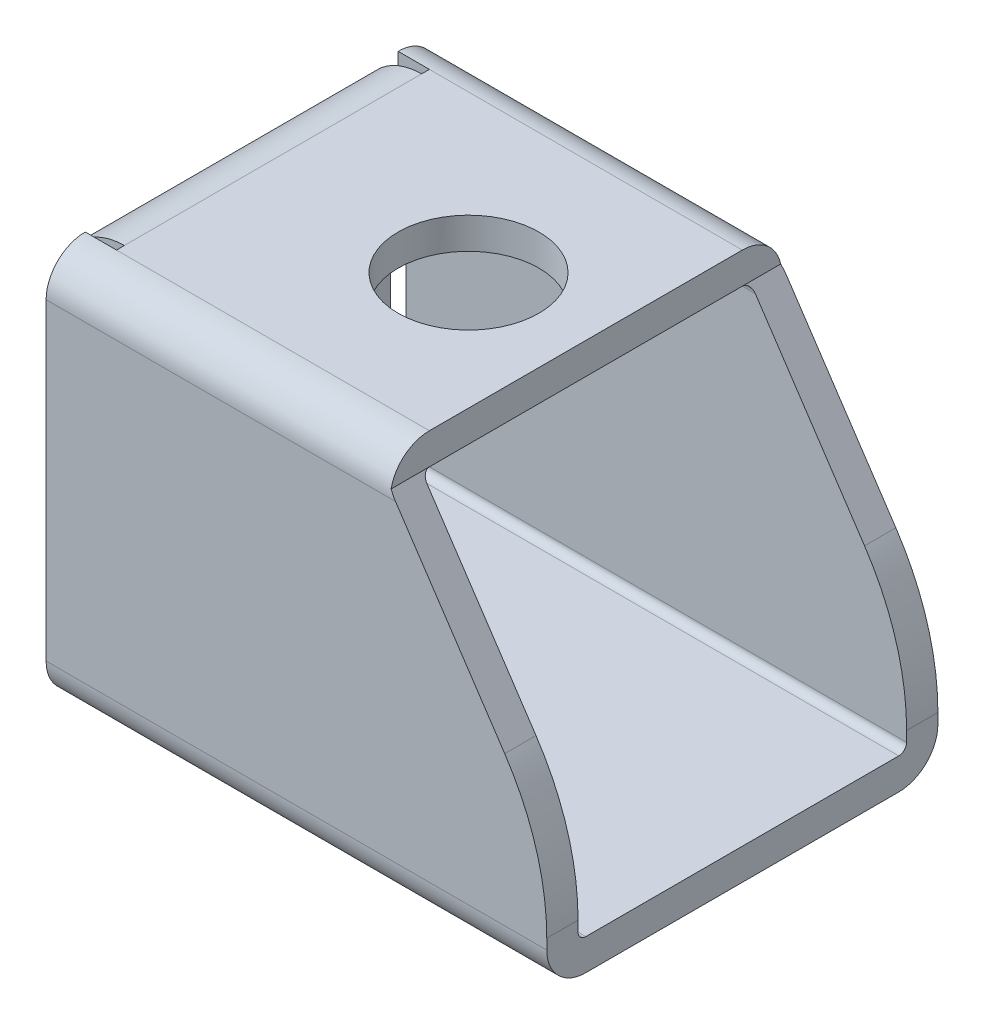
SolidWorks part; units mm, degrees
ref_plane "Plan de face" through (0, 0, 0) normal (0, 0, 1) x (1, 0, 0)
ref_plane "Plan de dessus" through (0, 0, 0) normal (0, 1, 0) x (1, 0, 0)
ref_plane "Plan de droite" through (0, 0, 0) normal (1, 0, 0) x (0, 0, -1)
sketch "Esquisse1" plane through (0, 0, 0) normal (1, 0, 0) x (0, 0, -1)
  line L0 (-10, 10.5) -> (10, 10.5)
  line L1 (-10, 12.5) -> (10, 12.5)
  line L2 (-12.5, 10) -> (-12.5, -10)
  line L3 (-10, -12.5) -> (10, -12.5)
  line L4 (12.5, 10) -> (12.5, -10)
  line L5 (-12.5, 12.5) -> (12.5, -12.5) construction
  line L6 (-12.5, -12.5) -> (12.5, 12.5) construction
  line L7 (10.5, 10) -> (10.5, -10)
  line L8 (-10, -10.5) -> (10, -10.5)
  line L9 (-10.5, 10) -> (-10.5, -10)
  arc A0 (-12.5, -10) -> (-10, -12.5) centre (-10, -10) ccw
  arc A1 (10, -12.5) -> (12.5, -10) centre (10, -10) ccw
  arc A2 (10, 12.5) -> (12.5, 10) centre (10, 10) cw
  arc A3 (-10, 12.5) -> (-12.5, 10) centre (-10, 10) ccw
  arc A4 (10, 10.5) -> (10.5, 10) centre (10, 10) cw
  arc A5 (10, -10.5) -> (10.5, -10) centre (10, -10) ccw
  arc A6 (-10.5, -10) -> (-10, -10.5) centre (-10, -10) ccw
  arc A7 (-10, 10.5) -> (-10.5, 10) centre (-10, 10) ccw
  point P0 (0, 0)
  dimension "D3" = 2.5
  dimension "D1" = 25
  dimension "D2" = 25
  dimension "D4" = 2
extrude "Boss.-Extru.1" add sketch "Esquisse1" along normal blind 32
sketch "Esquisse2" plane through (0, 0, 12.5) normal (0, 0, 1) x (1, 0, 0)
  line L0 (22, 12.5) -> (22, 10.5)
  line L1 (32, 12.5) -> (0, 12.5) construction
  line L2 (22, 10.5) -> (32, -4.5)
  line L3 (32, 10) -> (32, -10) construction
  line L4 (0, 12.5) -> (0, 10) construction
  line L5 (32, -12.5) -> (0, -12.5) construction
  dimension "D1" = 22
  dimension "D2" = 2
  dimension "D3" = 8
extrude "Enlèv. mat.-Extru.1" cut sketch "Esquisse2" against normal through all and the other way through all
fillet "Congé1" radius 16 2 edges at (32, -4.5, -11.5) (32, -4.5, 11.5)
sketch "Esquisse3" plane through (0, 0, 0) normal (-1, 0, 0) x (0, 0, 1)
  line L0 (-10, 12.5) -> (10, 12.5) construction
  line L1 (-10, 10.5) -> (10, 10.5)
  line L2 (-10, 10.5) -> (-10, 12.5)
  line L3 (-10, 12.5) -> (10, 12.5)
  line L4 (10, 10.5) -> (10, 12.5)
  arc A0 (12.5, 10) -> (10, 12.5) centre (10, 10) ccw construction
extrude "Enlèv. mat.-Extru.2" cut sketch "Esquisse3" against normal blind 2
sketch "Esquisse4" plane through (0, 0, 0) normal (0, 0, 1) x (1, 0, 0)
  line L0 (0, -9) -> (0, 8.5)
  line L3 (2, 10.5) -> (0, 10.5) construction
  line L5 (32, -10.5) -> (0, -10.5) construction
  arc A0 (0, 8.5) -> (2, 10.5) centre (2, 8.5) cw
  dimension "D1" = 2
  dimension "D2" = 1.5
sketch "Esquisse5" plane through (2, 0, 0) normal (-1, 0, 0) x (0, 0, 1)
  line L0 (0, 7.1633) -> (0, 15.1317) construction
  line L1 (0, -9) -> (0, 8.5) construction
  line L4 (-10, 12.5) -> (-10, 10.5)
  line L5 (-10, 10.5) -> (10, 10.5)
  line L6 (10, 10.5) -> (10, 12.5)
  line L7 (10, 12.5) -> (-10, 12.5)
  line L8 (-9.5, 12.5) -> (-9.5, 10.5)
  line L9 (-9.5, 10.5) -> (9.5, 10.5)
  line L10 (9.5, 10.5) -> (9.5, 12.5)
  line L11 (9.5, 12.5) -> (-9.5, 12.5)
  dimension "D2" = 19
  dimension "D1" = 0
sweep "Balayage3" add profiles "Esquisse5" path "Esquisse4"
sketch "Esquisse6" plane through (0, 12.5, 0) normal (0, 1, 0) x (1, 0, 0)
  line L0 (22, -10) -> (22, 10) construction
  circle A0 centre (14.5, 0) radius 4.5
  dimension "D1" = 9
  dimension "D2" = 7.5
extrude "Enlèv. mat.-Extru.3" cut sketch "Esquisse6" against normal up to next
